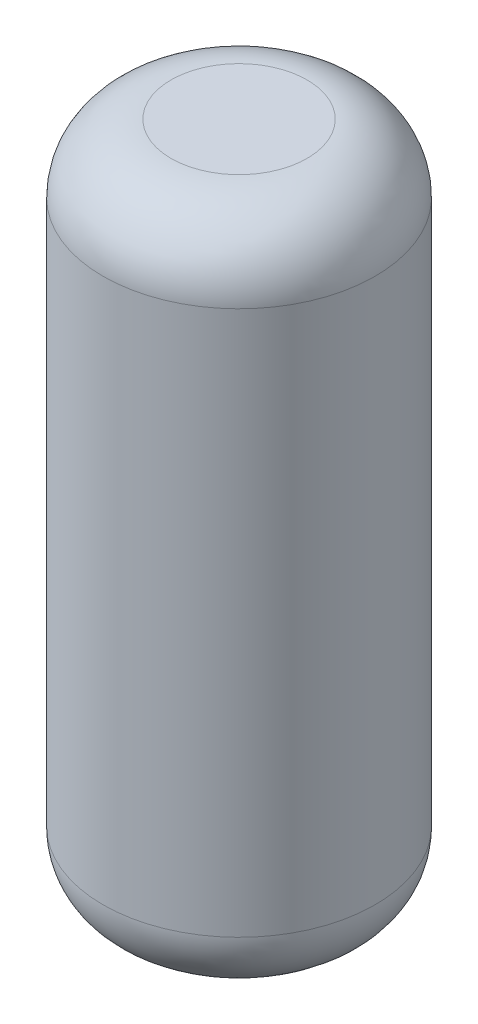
SolidWorks part; units mm, degrees
ref_plane "Plan de face" through (0, 0, 0) normal (0, 0, 1) x (1, 0, 0)
ref_plane "Plan de dessus" through (0, 0, 0) normal (0, 1, 0) x (1, 0, 0)
ref_plane "Plan de droite" through (0, 0, 0) normal (1, 0, 0) x (0, 0, -1)
sketch "Esquisse1" plane through (0, 0, 0) normal (0, 1, 0) x (1, 0, 0)
  circle A0 centre (0, 0) radius 2
  dimension "D1" = 4
extrude "Boss.-Extru.1" add sketch "Esquisse1" along normal blind 10
fillet "Congé1" radius 1 2 edges at (0, 10, 2) (0, 0, 2)
